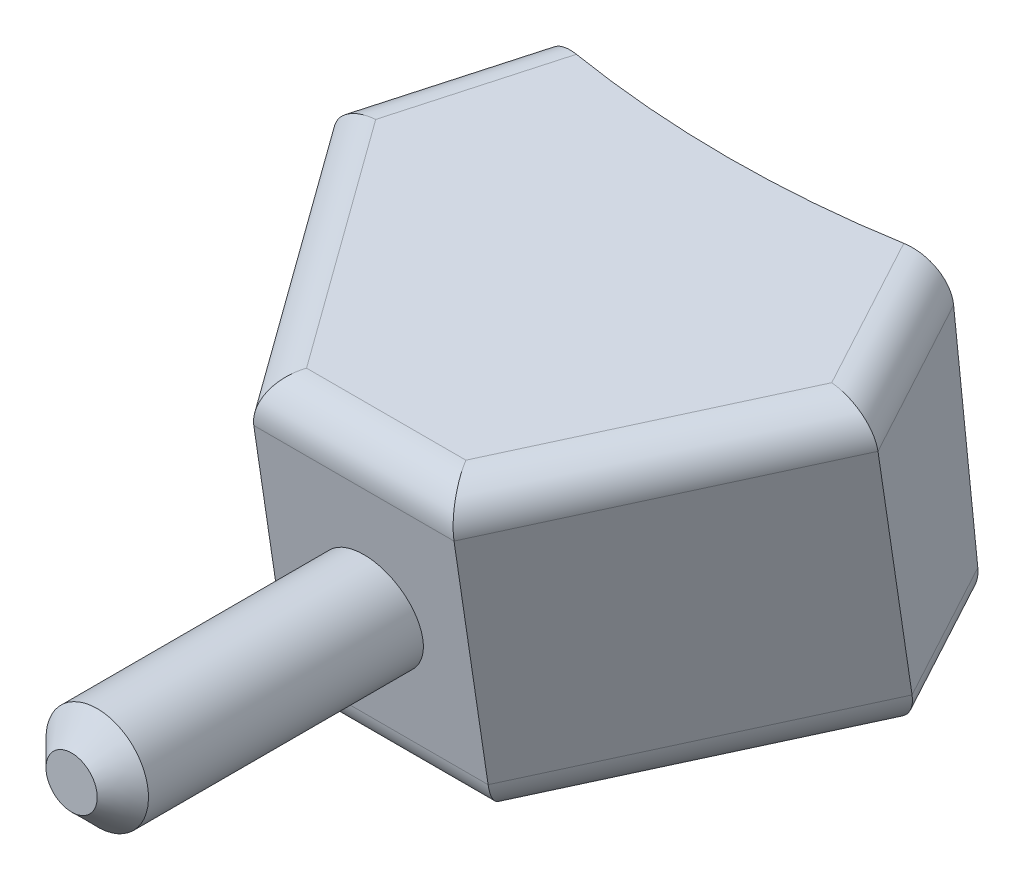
SolidWorks part; units mm, degrees
ref_plane "Plan de face" through (0, 0, 0) normal (0, 0, 1) x (1, 0, 0)
ref_plane "Plan de dessus" through (0, 0, 0) normal (0, 1, 0) x (1, 0, 0)
ref_plane "Plan de droite" through (0, 0, 0) normal (1, 0, 0) x (0, 0, -1)
ref_plane "Plan1" through (0, 3.0401, 0.4544) normal (0, 0.989, 0.1478) x (-1, 0, 0)
sketch "Esquisse1" plane through (0, 3.0401, 0.4544) normal (0, 0.989, 0.1478) x (-1, 0, 0)
  line L0 (-5.3092, -5.0102) -> (-3.9636, -7.8959)
  line L1 (3.9636, -7.8959) -> (5.3092, -5.0102)
  line L2 (5.3092, -5.0102) -> (1.9541, -0.0359)
  line L3 (1.9541, -0.0359) -> (-1.9541, -0.0359)
  line L4 (-1.9541, -0.0359) -> (-5.3092, -5.0102)
  arc A0 (-3.9636, -7.8959) -> (3.9636, -7.8959) centre (0, -29.5359) cw
  dimension "D1" = 22
  dimension "D2" = 121
  dimension "D4" = 121
extrude "Extrusion1" add sketch "Esquisse1" against normal blind 6
ref_plane "Plan2" through (0, 0, 5.8177) normal (0, 0, 1) x (1, 0, 0)
sketch "Esquisse2" plane through (0, 0, 5.8177) normal (0, 0, 1) x (1, 0, 0)
  circle A0 centre (0, 0) radius 1
extrude "Extrusion2" add sketch "Esquisse2" against normal up to next
draft "Dépouille1" type of draft neutral plane draft angle 5 faces to draft 1 parameters "D1"=5
fillet "Congé1" radius 0.75 5 edges at (4.7509, -1.9764, -6.5717) (3.6316, -2.521, -2.9278) (0, -2.8886, -0.4681) (-3.6316, -2.521, -2.9278) (-4.7509, -1.9764, -6.5717)
fillet "Congé2" radius 0.75 5 edges at (4.6364, 3.994, -5.9278) (3.6316, 3.4131, -2.041) (-4.6364, 3.994, -5.9278) (0, 3.0455, 0.4188) (-3.6316, 3.4131, -2.041)
chamfer "Chanfrein1" distance 0.5 angle 45 1 edges at (-1, 0, 5.8177)
